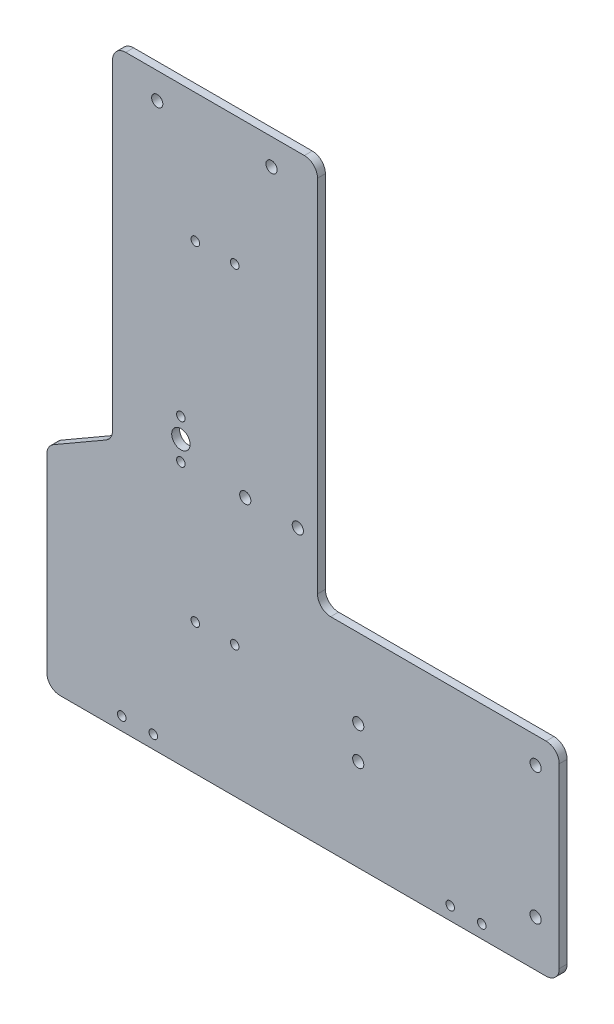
SolidWorks part; units mm, degrees
ref_plane "Face" through (0, 0, 0) normal (0, 0, 1) x (1, 0, 0)
ref_plane "Dessus" through (0, 0, 0) normal (0, 1, 0) x (1, 0, 0)
ref_plane "Droite" through (0, 0, 0) normal (1, 0, 0) x (0, 0, -1)
sketch "Esquisse1" plane through (0, 0, 0) normal (0, 0, 1) x (1, 0, 0)
  line L1 (-85.5227, 369.7569) -> (304.4773, 369.7569)
  line L2 (-85.5227, 369.7569) -> (-85.5227, -79.2431)
  line L3 (-85.5227, -79.2431) -> (304.4773, -79.2431)
  line L4 (304.4773, 369.7569) -> (304.4773, -79.2431)
  dimension "D1" = 390
  dimension "D2" = 449
extrude "Base-Extrusion" add sketch "Esquisse1" along normal blind 6
sketch "Esquisse2" plane through (0, 0, 6) normal (0, 0, 1) x (1, 0, 0)
  line L0 (304.4773, 369.7569) -> (-85.5227, 369.7569) construction
  line L1 (120.4773, 369.7569) -> (304.4773, 369.7569)
  line L2 (120.4773, 369.7569) -> (120.4773, 75.7569)
  line L3 (120.4773, 75.7569) -> (304.4773, 75.7569)
  line L4 (304.4773, 369.7569) -> (304.4773, 75.7569)
  line L5 (304.4773, -79.2431) -> (304.4773, 369.7569) construction
  dimension "D1" = 294
  dimension "D2" = 184
extrude "Enlèv. mat.-Extru.1" cut sketch "Esquisse2" against normal blind 6
sketch "Esquisse3" plane through (0, 0, 6) normal (0, 0, 1) x (1, 0, 0)
  line L0 (120.4773, 369.7569) -> (120.4773, 75.7569) construction
  line L1 (-85.5227, 369.7569) -> (-35.5227, 369.7569)
  line L2 (-85.5227, 369.7569) -> (-85.5227, 80.7569)
  line L3 (-85.5227, 80.7569) -> (-35.5227, 80.7569)
  line L4 (-35.5227, 369.7569) -> (-35.5227, 80.7569)
  line L5 (-85.5227, -79.2431) -> (304.4773, -79.2431) construction
  dimension "D1" = 156
  dimension "D2" = 160
extrude "Enlèv. mat.-Extru.2" cut sketch "Esquisse3" against normal blind 6
chamfer "Chanfrein5" distance 50 angle 30 1 edges at (-35.5227, 80.7569, 3)
sketch "Esquisse4" plane through (0, 0, 6) normal (0, 0, 1) x (1, 0, 0)
  line L0 (120.4773, 369.7569) -> (120.4773, 75.7569) construction
  line L1 (120.4773, 369.7569) -> (-35.5227, 369.7569) construction
  line L2 (-35.5227, 109.6244) -> (-35.5227, 369.7569) construction
  circle A0 centre (-1.5227, 349.7569) radius 4.25
  circle A1 centre (85.4773, 349.7569) radius 4.25
  circle A2 centre (27.4773, 271.7569) radius 3.25
  circle A3 centre (57.4773, 271.7569) radius 3.25
  dimension "D1" = 8.5
  dimension "D2" = 8.5
  dimension "D4" = 35
  dimension "D5" = 20
  dimension "D6" = 20
  dimension "D7" = 6.5
  dimension "D8" = 6.5
  dimension "D9" = 98
  dimension "D10" = 98
  dimension "D11" = 30
  dimension "D12" = 63
  dimension "D3" = 87
extrude "Enlèv. mat.-Extru.3" cut sketch "Esquisse4" against normal blind 6
sketch "Esquisse5" plane through (0, 0, 6) normal (0, 0, 1) x (1, 0, 0)
  line L0 (120.4773, 369.7569) -> (120.4773, 75.7569) construction
  line L1 (120.4773, 75.7569) -> (304.4773, 75.7569) construction
  line L2 (-35.5227, 109.6244) -> (-35.5227, 369.7569) construction
  circle A0 centre (16.4773, 150.7569) radius 3.25
  circle A1 centre (16.4773, 135.7569) radius 7
  circle A2 centre (16.4773, 120.7569) radius 3.25
  circle A3 centre (65.4773, 121.7569) radius 4.25
  circle A4 centre (105.4773, 121.7569) radius 4.25
  dimension "D1" = 6.5
  dimension "D2" = 14
  dimension "D3" = 6.5
  dimension "D4" = 8.5
  dimension "D5" = 8.5
  dimension "D6" = 15
  dimension "D7" = 40
  dimension "D8" = 46
  dimension "D9" = 45
  dimension "D10" = 52
  dimension "D11" = 52
  dimension "D12" = 52
  dimension "D13" = 15
  dimension "D14" = 15
extrude "Enlèv. mat.-Extru.4" cut sketch "Esquisse5" against normal blind 6
sketch "Esquisse6" plane through (0, 0, 6) normal (0, 0, 1) x (1, 0, 0)
  line L0 (-35.5227, 109.6244) -> (-35.5227, 369.7569) construction
  line L1 (-85.5227, -79.2431) -> (304.4773, -79.2431) construction
  line L2 (304.4773, -79.2431) -> (304.4773, 75.7569) construction
  circle A0 centre (27.4773, 20.7569) radius 3.25
  circle A1 centre (57.4773, 20.7569) radius 3.25
  circle A2 centre (151.4773, 15.7569) radius 4.25
  circle A3 centre (151.4773, -9.2431) radius 4.25
  circle A4 centre (221.4773, -69.2431) radius 3.25
  circle A5 centre (245.4773, -69.2431) radius 3.25
  dimension "D1" = 63
  dimension "D2" = 30
  dimension "D3" = 6.5
  dimension "D4" = 6.5
  dimension "D5" = 8.5
  dimension "D6" = 8.5
  dimension "D7" = 100
  dimension "D8" = 100
  dimension "D9" = 70
  dimension "D10" = 25
  dimension "D11" = 59
  dimension "D12" = 24
  dimension "D13" = 6.5
  dimension "D14" = 6.5
  dimension "D15" = 70
  dimension "D16" = 10
extrude "Enlèv. mat.-Extru.5" cut sketch "Esquisse6" against normal blind 6
sketch "Esquisse7" plane through (0, 0, 6) normal (0, 0, 1) x (1, 0, 0)
  line L0 (120.4773, 75.7569) -> (304.4773, 75.7569) construction
  line L1 (304.4773, -79.2431) -> (304.4773, 75.7569) construction
  line L2 (-85.5227, -79.2431) -> (304.4773, -79.2431) construction
  line L3 (-85.5227, 80.7569) -> (-85.5227, -79.2431) construction
  circle A0 centre (286.4773, -44.2431) radius 4.25
  circle A1 centre (286.4773, 55.7569) radius 4.25
  circle A2 centre (-4.5227, -69.2431) radius 3.25
  circle A3 centre (-28.5227, -69.2431) radius 3.25
  dimension "D1" = 20
  dimension "D2" = 8.5
  dimension "D3" = 8.5
  dimension "D4" = 18
  dimension "D5" = 18
  dimension "D6" = 100
  dimension "D7" = 10
  dimension "D8" = 10
  dimension "D9" = 6.5
  dimension "D10" = 6.5
  dimension "D11" = 24
  dimension "D12" = 57
extrude "Enlèv. mat.-Extru.6" cut sketch "Esquisse7" against normal blind 6
fillet "Congé1" radius 10 8 edges at (120.4773, 75.7569, 3) (120.4773, 369.7569, 3) (304.4773, 75.7569, 3) (-85.5227, 80.7569, 3) (-35.5227, 369.7569, 3) (-35.5227, 109.6244, 3) (304.4773, -79.2431, 3) (-85.5227, -79.2431, 3)
